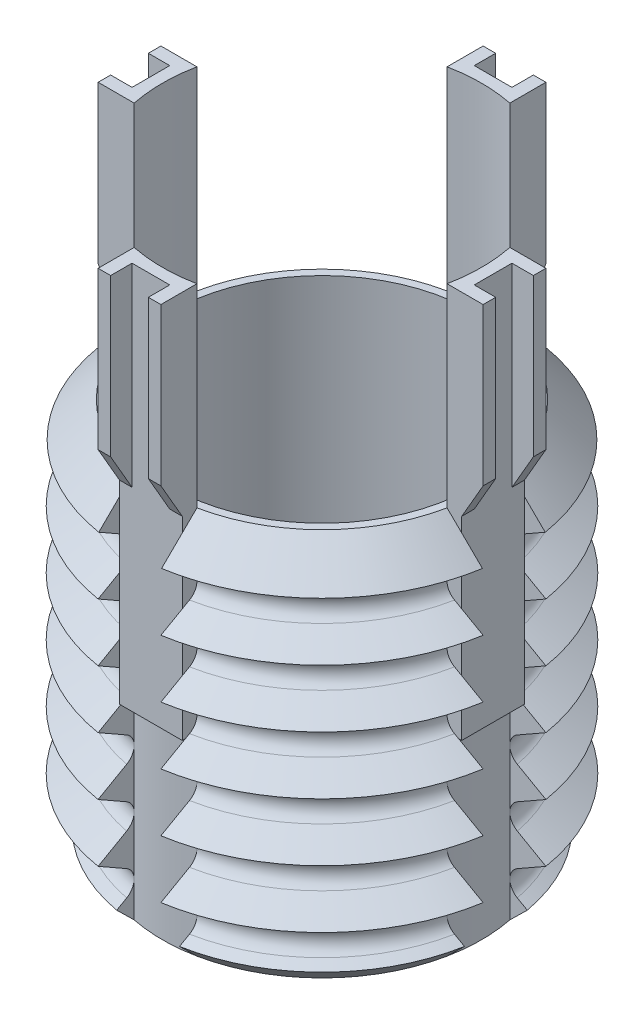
SolidWorks part; units mm, degrees
ref_plane "Front Plane" through (0, 0, 0) normal (0, 0, 1) x (1, 0, 0)
ref_plane "Top Plane" through (0, 0, 0) normal (0, 1, 0) x (1, 0, 0)
ref_plane "Right Plane" through (0, 0, 0) normal (1, 0, 0) x (0, 0, -1)
sketch "Sketch1" plane through (0, 0, 0) normal (0, 1, 0) x (1, 0, 0)
  circle A0 centre (0, 0) radius 7.144
  circle A1 centre (0, 0) radius 5.5565
  dimension "D1" = 11.113
  dimension "D2" = 14.288
extrude "Boss-Extrude1" add sketch "Sketch1" along normal mid plane 14.22
sketch "Sketch2" plane through (0, 7.11, 0) normal (0, 1, 0) x (1, 0, 0)
  circle A0 centre (0, 0) radius 5.845
  dimension "D1" = 11.69
extrude "Cut-Extrude1" cut sketch "Sketch2" against normal through all draft 45 flip side to cut
mirror "Mirror1" about plane through (0, 0, 0) normal (0, 1, 0) of "Cut-Extrude1"
sketch "Sketch3" plane through (0, 7.11, 0) normal (0, 1, 0) x (1, 0, 0)
  line L0 (-7.144, 0) -> (-7.144, 1.15)
  line L1 (-7.144, 1.15) -> (-5.7308, 1.15)
  line L2 (-7.144, 0) -> (-7.144, -1.15)
  line L3 (-7.144, -1.15) -> (-5.7308, -1.15)
  arc A0 (-5.7308, 1.15) -> (-5.7308, -1.15) centre (0, 0) ccw
  circle A1 centre (0, 0) radius 5.845 construction
  circle A2 centre (0, 0) radius 7.144 construction
  dimension "D1" = 2.3
extrude "Cut-Extrude2" cut sketch "Sketch3" against normal through all
sketch "Sketch4" plane through (0, 0, 0) normal (0, 0, 1) x (1, 0, 0)
  line L1 (7.144, -5.811) -> (7.144, -6.871)
  line L3 (7.144, -6.871) -> (6.1135, -6.276)
  line L6 (6.1135, -5.346) -> (7.144, -4.751)
  line L10 (7.144, -5.811) -> (7.144, 5.811) construction
  line L12 (7.144, -4.751) -> (7.144, -5.811)
  arc A1 (6.1135, -6.276) -> (6.1135, -5.346) centre (6.382, -5.811) cw
  point P5 (5.845, -7.11)
  point P9 (5.845, -5.811)
  dimension "D2" = 60
  dimension "D1" = 2.12
revolve "Cut-Revolve1" cut sketch "Sketch4" angle 360 about axis through (0, 7.11, 0) along (0, -1, 0)
pattern_linear "LPattern1" count 6 spacing 2.12 along (0, 1, 0) of "Cut-Revolve1"
sketch "Sketch5" plane through (0, 7.11, 0) normal (0, -1, 0) x (1, 0, 0)
  line L0 (-5.7308, 1.15) -> (-7.0508, 1.15)
  line L1 (-5.7308, -1.15) -> (-7.0508, -1.15)
  line L2 (-6.2671, -0.69) -> (-7.0508, -0.69)
  line L3 (-6.2671, 0.69) -> (-7.0508, 0.69)
  line L4 (-7.0508, 1.15) -> (-7.0508, 0.69)
  line L5 (-7.0508, -0.69) -> (-7.0508, -1.15)
  line L6 (-6.2671, 0.69) -> (-6.2671, -0.69)
  arc A0 (-5.7308, 1.15) -> (-5.7308, -1.15) centre (0, 0) ccw
  arc A1 (-5.7308, 1.15) -> (-5.7308, -1.15) centre (0, 0) ccw construction
  arc A3 (-6.2671, 0.69) -> (-6.2671, -0.69) centre (0, 0) ccw construction
  dimension "D1" = 0.46
extrude "Boss-Extrude2" add sketch "Sketch5" along normal mid plane 14.22
sketch "Sketch6" plane through (0, 0, 0) normal (0, 0, 1) x (1, 0, 0)
  line L9 (-6.2671, 7.11) -> (-7.0508, 8.4674)
  line L10 (-6.2671, 0) -> (-6.2671, 14.22) construction
  line L11 (-7.0508, 0) -> (-7.0508, 14.22) construction
  line L12 (-7.0508, 8.4674) -> (-7.0508, 0)
  line L13 (-7.0508, 0) -> (-6.2671, 0)
  line L15 (-6.2671, 0) -> (-6.2671, 7.11)
  line L16 (5.5565, 7.11) -> (-5.5565, 7.11) construction
  dimension "D1" = 150
extrude "Cut-Extrude3" cut sketch "Sketch6" against normal mid plane 2.3
pattern_circular "CirPattern1" count 4 over 360 about axis through (0, 0, 0) along (0, 1, 0) of "Cut-Extrude2", "Boss-Extrude2", "Cut-Extrude3"
